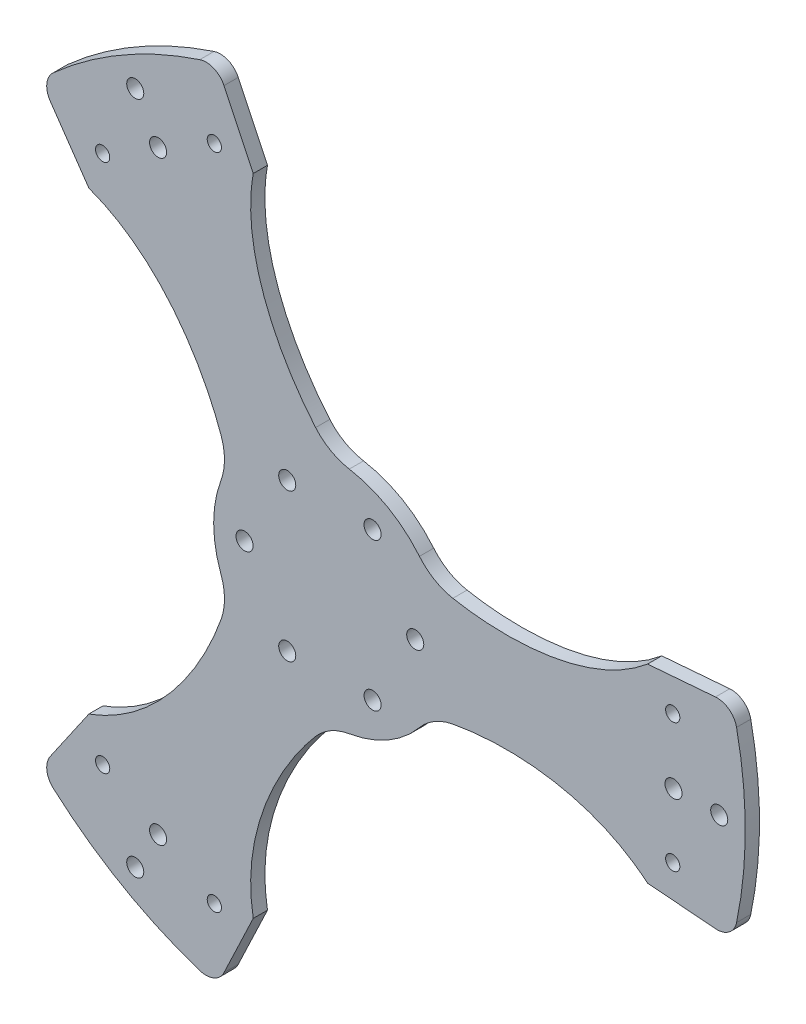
SolidWorks part; units mm, degrees
ref_plane "Front Plane" through (0, 0, 0) normal (0, 0, 1) x (1, 0, 0)
ref_plane "Top Plane" through (0, 0, 0) normal (0, 1, 0) x (1, 0, 0)
ref_plane "Right Plane" through (0, 0, 0) normal (1, 0, 0) x (0, 0, -1)
sketch "Sketch1" plane through (0, 0, 0) normal (0, 0, 1) x (1, 0, 0)
  circle A0 centre (0, 0) radius 150
sketch "Sketch2" plane through (0, 0, 0) normal (0, 0, 1) x (1, 0, 0)
  line L0 (0, 0) -> (-127.1352, -76.9278) construction
  line L1 (0, 0) -> (-147.7095, 0) construction
  line L2 (-127.1352, -76.9278) -> (-93.3529, -56.4866) construction
  line L3 (-93.3529, -56.4866) -> (-110.2441, -66.7072) construction
  line L4 (47.841, -29.6123) -> (109.3221, -22.6687)
  line L5 (-57.5479, 0) -> (57.5479, 0) construction
  line L8 (-40.6314, 1.8196) -> (-40.6314, -10.2417) construction
  line L9 (47.841, 29.6123) -> (109.3221, 22.6687)
  line L12 (68.4268, -9.3283) -> (68.4268, 9.3283) construction
  line L14 (-11.4185, -116.6276) -> (-11.4185, -56.0943)
  line L15 (29.3609, -55.3764) -> (14.4849, -116.0238)
  line L16 (29.3609, 55.3764) -> (14.4849, 116.0238)
  line L17 (-11.4185, 116.6276) -> (-11.4185, 56.0943)
  line L20 (68.4268, -9.3283) -> (88.7411, -6.9965) construction
  line L21 (88.7411, -6.9965) -> (91.2607, 0) construction
  line L22 (88.7411, 6.9965) -> (91.2607, 0) construction
  line L23 (68.4268, 9.3283) -> (88.7411, 6.9965) construction
  arc A3 (-127.1352, -76.9278) -> (-123.1116, -83.2152) centre (0, 0) ccw
  arc A4 (-11.4185, 56.0943) -> (-30.9914, 48.1299) centre (0, 0) ccw
  arc A5 (-30.9914, -48.1299) -> (-11.4185, -56.0943) centre (0, 0) ccw
  arc A6 (-93.3529, 56.4866) -> (-127.1352, 76.9278) centre (-110.2441, 66.7072) cw
  arc A7 (-127.1352, 76.9278) -> (-123.1116, 83.2152) centre (0, 0) cw
  circle A13 centre (-79.8943, -93.0442) radius 2.5
  circle A14 centre (-40.6314, -115.7126) radius 2.5
  circle A15 centre (-68.4351, -118.5331) radius 3
  circle A16 centre (-60.3981, -104.6126) radius 3
  circle A17 centre (120.7962, 0) radius 3
  circle A18 centre (120.5258, -22.6684) radius 2.5
  circle A19 centre (136.8702, 0) radius 3
  circle A20 centre (120.5258, 22.6684) radius 2.5
  circle A21 centre (-40.6314, 115.7126) radius 2.5
  circle A22 centre (-79.8943, 93.0442) radius 2.5
  circle A23 centre (-60.3981, 104.6126) radius 3
  circle A24 centre (-68.4351, 118.5331) radius 3
  arc A27 (-93.3529, -56.4866) -> (-127.1352, -76.9278) centre (-110.2441, -66.7072) ccw
  spline S0 degree 3 poles (-10.2197, -156.6096) (37.8237, -155.1691) (130.1518, -159.2943) (149.7948, -69.0357) (149.7948, 0) knots 0 0 0 0 0.441753 1 1 1 1
  spline S1 degree 3 poles (-10.2197, 156.6096) (37.8237, 155.1691) (130.1518, 159.2943) (149.7948, 69.0357) (149.7948, 0) knots 0 0 0 0 0.441753 1 1 1 1
  spline S2 degree 1 poles (-11.4185, -116.6276) (109.7948, 0) knots 0 0 1 1 construction
  spline S3 degree 1 poles (-11.4185, 116.6276) (109.7948, 0) knots 0 0 1 1 construction
  spline S4 degree 3 poles (-11.4185, -116.6276) (-9.6757, -116.5753) (-6.1661, -116.478) (0.662, -116.3121) (6.7465, -116.1857) (12.6489, -116.0633) (16.0687, -115.9902) (21.2371, -115.872) (30.7664, -115.624) (44.3606, -115.0563) (58.6191, -113.7923) (70.1707, -111.8349) (77.247, -109.7299) (81.3977, -107.9561) (83.4275, -106.856) (84.7967, -105.978) (86.1402, -105.016) (88.4098, -103.1117) (91.6874, -99.4744) (95.8124, -92.8483) (99.8274, -83.5535) (103.3892, -71.5601) (105.7817, -59.4467) (107.2911, -48.5919) (108.2154, -39.8962) (108.8262, -31.9992) (109.2048, -25.3682) (109.4969, -18.7817) (109.684, -12.1941) (109.7787, -5.4131) (109.7948, -1.7954) (109.7948, 0) knots 0 0 0 0 0.015625 0.03125 0.0625 0.072901 0.088526 0.096339 0.125 0.1875 0.25 0.3125 0.375 0.40625 0.4375 0.453125 0.46875 0.5 0.5625 0.625 0.6875 0.75 0.8125 0.84375 0.875 0.90625 0.924005 0.93963 0.96875 0.984375 1 1 1 1 only from (14.4849, -116.0238) to (109.3221, -22.6687)
  spline S5 degree 3 poles (109.7948, 0) (109.7948, 1.7954) (109.7787, 5.4131) (109.684, 12.1941) (109.4969, 18.7817) (109.2048, 25.3682) (108.8262, 31.9992) (108.2154, 39.8962) (107.2911, 48.5919) (105.7817, 59.4467) (103.3892, 71.5601) (99.8274, 83.5535) (95.8124, 92.8483) (91.6874, 99.4744) (88.4098, 103.1117) (86.1402, 105.016) (84.7967, 105.978) (83.4275, 106.856) (81.3977, 107.9561) (77.247, 109.7299) (70.1707, 111.8349) (58.6191, 113.7923) (44.3606, 115.0563) (30.7664, 115.624) (21.2371, 115.872) (16.0687, 115.9902) (12.6489, 116.0633) (6.7465, 116.1857) (0.662, 116.3121) (-6.1661, 116.478) (-9.6757, 116.5753) (-11.4185, 116.6276) knots 0 0 0 0 0.015625 0.03125 0.06037 0.075995 0.09375 0.125 0.15625 0.1875 0.25 0.3125 0.375 0.4375 0.5 0.53125 0.546875 0.5625 0.59375 0.625 0.6875 0.75 0.8125 0.875 0.903661 0.911474 0.927099 0.9375 0.96875 0.984375 1 1 1 1 only from (109.3221, 22.6687) to (14.4849, 116.0238)
  spline S6 degree 3 poles (-10.2197, -156.6096) (-55.2159, -157.9588) (-94.9923, -114.5222) (-123.1116, -83.2152) knots 0 0 0 0 1 1 1 1
  spline S7 degree 1 poles (-11.4185, -116.6276) (-93.3529, -56.4866) knots 0 0 1 1 construction
  spline S8 degree 3 poles (-11.4185, -116.6276) (-12.0035, -116.6451) (-13.165, -116.6441) (-15.563, -116.4981) (-18.7217, -116.0327) (-22.887, -114.955) (-28.9669, -112.7395) (-37.4836, -108.3933) (-48.6248, -100.7244) (-60.1297, -91.065) (-69.6814, -81.8692) (-77.1676, -74.1506) (-82.6847, -68.259) (-87.186, -63.3295) (-90.7317, -59.4033) (-92.4776, -57.4611) (-93.3529, -56.4866) knots 0 0 0 0 0.03125 0.0625 0.125 0.1875 0.25 0.375 0.5 0.625 0.75 0.8125 0.875 0.9375 0.96875 1 1 1 1
  spline S9 degree 3 poles (-10.2197, 156.6096) (-55.2159, 157.9588) (-94.9923, 114.5222) (-123.1116, 83.2152) knots 0 0 0 0 1 1 1 1
  spline S10 degree 3 poles (-11.4185, 116.6276) (-12.0427, 116.6295) (-13.2821, 116.5968) (-15.8277, 116.3841) (-19.0976, 115.8397) (-22.2679, 114.9786) (-24.8387, 114.1167) (-26.4401, 113.5198) (-30.8601, 111.7001) (-38.176, 107.9142) (-49.2151, 100.2805) (-60.5644, 90.7355) (-71.8623, 79.8426) (-81.0228, 70.156) (-88.1503, 62.3128) (-91.6151, 58.4365) (-93.3529, 56.4866) knots 0 0 0 0 0.03125 0.0625 0.125 0.185146 0.200771 0.232021 0.25 0.375 0.5 0.625 0.75 0.875 0.9375 1 1 1 1
  spline S11 degree 3 poles (29.3609, -55.3764) (43.9579, -52.6195) (45.3106, -44.4574) (47.2536, -33.2244) (47.841, -29.6123) knots 0.139441 0.139441 0.139441 0.139441 0.462059 0.606344 0.606344 0.606344 0.606344
  spline S12 degree 3 poles (29.3609, 55.3764) (43.9579, 52.6195) (45.3106, 44.4574) (47.2536, 33.2244) (47.841, 29.6123) knots 0.139441 0.139441 0.139441 0.139441 0.462059 0.606344 0.606344 0.606344 0.606344
  spline S13 degree 2 poles (-30.9914, -48.1299) (-40.6314, -24.9841) (-40.6314, 0) knots 0 0 0 1 1 1
  spline S14 degree 2 poles (-30.9914, 48.1299) (-40.6314, 24.9841) (-40.6314, 0) knots 0 0 0 1 1 1
  point P70 (68.4268, 0)
  point P71 (93.1284, 0)
  dimension "D1" = 40
  dimension "D2" = 40
extrude "Boss-Extrude1" [suppressed] add sketch "Sketch2" along normal blind 5 contours A4 S14 S13 A5 L14 S8 A27 A3 S6 S0 S1 S9 A7 A6 S10 L17 L15 S11 L4 S4 L12 L23 L22 L21 L20 A13 A14 A15 A16 A17 A18 A19 A20 A21 A22 A23 A24
fillet "Fillet1" [suppressed] radius 10
fillet "Fillet2" [suppressed] radius 10
fillet "Fillet3" [suppressed] radius 10
sketch "Sketch3" plane through (0, 0, 0) normal (0, 0, 1) x (1, 0, 0)
  line L0 (0, 0) -> (-73.0106, 126.458) construction
  line L1 (0, 0) -> (-84.7259, 80.0386) construction
  line L2 (-84.7259, 80.0386) -> (-101.7568, 104.7269) construction
  line L4 (-69.5384, 120.444) -> (-76.2871, 132.1331) construction
  circle A4 centre (-79.8943, 93.0442) radius 2.5
  circle A5 centre (-68.4351, 118.5331) radius 3
  circle A6 centre (-40.6314, 115.7126) radius 2.5
  circle A7 centre (-60.3981, 104.6126) radius 3
  circle A8 centre (136.8702, 0) radius 3
  circle A9 centre (120.7962, 0) radius 3
  circle A10 centre (120.5258, 22.6684) radius 2.5
  circle A11 centre (120.5258, -22.6684) radius 2.5
  circle A12 centre (-68.4351, -118.5331) radius 3
  circle A13 centre (-60.3981, -104.6126) radius 3
  circle A14 centre (-40.6314, -115.7126) radius 2.5
  circle A15 centre (-79.8943, -93.0442) radius 2.5
  arc A17 (-39.8178, 140.4874) -> (-101.7568, 104.7269) centre (0, 0) ccw
  arc A20 (-35.7782, 19.7592) -> (-35.7782, -19.7592) centre (0, 0) ccw
  arc A21 (141.5746, -35.7605) -> (141.5746, 35.7605) centre (0, 0) ccw
  arc A22 (-101.7568, -104.7269) -> (-39.8178, -140.4874) centre (0, 0) ccw
  arc A23 (0.7771, -40.8645) -> (35.0011, -21.1052) centre (0, 0) ccw
  arc A24 (35.0011, 21.1052) -> (0.7771, 40.8645) centre (0, 0) ccw
  spline S0 degree 3 poles (-84.7259, 80.0386) (-56.647, 69.8616) (-40.4589, 39.1523) (-35.7782, 19.7592) knots 0 0 0 0 1 1 1 1
  spline S1 degree 3 poles (-26.9525, 113.3941) (-32.1784, 83.9886) (-13.6774, 54.6146) (0.7771, 40.8645) knots 0 0 0 0 1 1 1 1
  spline S2 degree 1 poles (-101.7568, 104.7269) (-84.7259, 80.0386) knots 0 0 1 1
  spline S3 degree 1 poles (-39.8178, 140.4874) (-26.9525, 113.3941) knots 0 0 1 1
  spline S4 degree 3 poles (111.6784, -33.3555) (88.8254, -14.127) (54.1364, -15.4623) (35.0011, -21.1052) knots 0 0 0 0 1 1 1 1
  spline S5 degree 3 poles (111.6784, 33.3555) (88.8254, 14.127) (54.1364, 15.4623) (35.0011, 21.1052) knots 0 0 0 0 1 1 1 1
  spline S6 degree 1 poles (141.5746, 35.7605) (111.6784, 33.3555) knots 0 0 1 1
  spline S7 degree 1 poles (141.5746, -35.7605) (111.6784, -33.3555) knots 0 0 1 1
  spline S8 degree 3 poles (-84.7259, -80.0386) (-56.647, -69.8616) (-40.4589, -39.1523) (-35.7782, -19.7592) knots 0 0 0 0 1 1 1 1
  spline S9 degree 3 poles (-26.9525, -113.3941) (-32.1784, -83.9886) (-13.6774, -54.6146) (0.7771, -40.8645) knots 0 0 0 0 1 1 1 1
  spline S10 degree 1 poles (-39.8178, -140.4874) (-26.9525, -113.3941) knots 0 0 1 1
  spline S11 degree 1 poles (-101.7568, -104.7269) (-84.7259, -80.0386) knots 0 0 1 1
  point P27 (0, 0)
  point P50 (0, 0)
  point P51 (0, 0)
  dimension "D1" = 3
  dimension "D2" = 3
extrude "Boss-Extrude2" add sketch "Sketch3" along normal blind 5
fillet "Fillet4" [suppressed] radius 25
fillet "Fillet5" [suppressed] radius 6
fillet "Fillet6" radius 20 6 edges at (35.0011, -21.1052, 2.5) (0.7771, -40.8645, 2.5) (0.7771, 40.8645, 2.5) (35.0011, 21.1052, 2.5) (-35.7782, -19.7592, 2.5) (-35.7782, 19.7592, 2.5)
fillet "Fillet7" radius 7 6 edges at (-101.7568, -104.7269, 2.5) (-39.8178, -140.4874, 2.5) (141.5746, -35.7605, 2.5) (141.5746, 35.7605, 2.5) (-39.8178, 140.4874, 2.5) (-101.7568, 104.7269, 2.5)
sketch "Sketch4" plane through (0, 0, 5) normal (0, 0, 1) x (1, 0, 0)
  circle A6 centre (15, 25.9808) radius 3
  circle A7 centre (30, 0) radius 3
  circle A8 centre (15, -25.9808) radius 3
  circle A9 centre (-15, -25.9808) radius 3
  circle A10 centre (-30, 0) radius 3
  circle A11 centre (-15, 25.9808) radius 3
extrude "Cut-Extrude1" cut sketch "Sketch4" against normal blind 10
